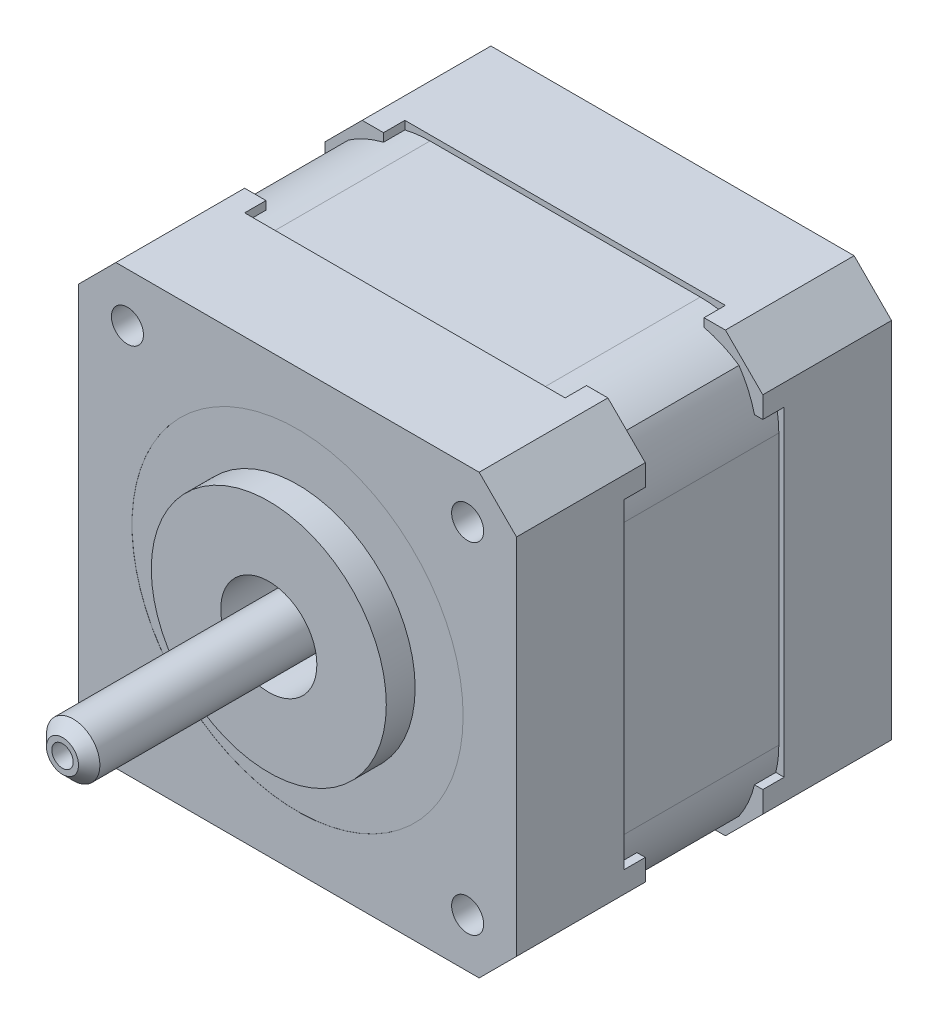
SolidWorks part; units mm, degrees
ref_plane "Ön Düzlem" through (0, 0, 0) normal (0, 0, 1) x (1, 0, 0)
ref_plane "Üst Düzlem" through (0, 0, 0) normal (0, 1, 0) x (1, 0, 0)
ref_plane "Sağ Düzlem" through (0, 0, 0) normal (1, 0, 0) x (0, 0, -1)
sketch "Çizim1" plane through (0, 0, 0) normal (0, 0, 1) x (1, 0, 0)
  line L3 (-17, 41) -> (17, 41)
  line L4 (20.5, 3.5) -> (20.5, 37.5)
  line L5 (-20.5, 3.5) -> (-20.5, 37.5)
  line L6 (17, 41) -> (20.5, 37.5)
  line L7 (-17, 41) -> (-20.5, 37.5)
  line L8 (17, 0) -> (20.5, 3.5)
  line L9 (-17, 0) -> (-20.5, 3.5)
  line L10 (-17, 0) -> (17, 0)
extrude "Yükseklik-Ekstrüzyon2" add sketch "Çizim1" along normal blind 10.05
sketch "Çizim5" plane through (0, 0, 0) normal (0, 0, -1) x (-1, 0, 0)
  line L0 (-20.5, 3.5) -> (-20.5, 5.5)
  line L1 (-20.5, 3.5) -> (-20.5, 37.5) construction
  line L2 (-20.5, 5.5) -> (-20, 5.5)
  line L3 (-17, 0) -> (-15, 0)
  line L4 (17, 0) -> (-17, 0) construction
  line L5 (-15, 0) -> (-15, 0.5)
  line L6 (20.5, 20.5) -> (10.3627, 20.5)
  line L7 (15, 0) -> (15, 0.5)
  line L8 (-20, 3.7071) -> (-20, 37.2929)
  line L9 (-20, 37.2929) -> (-16.7929, 40.5)
  line L10 (-16.7929, 40.5) -> (16.7929, 40.5)
  line L11 (16.7929, 40.5) -> (20, 37.2929)
  line L12 (20, 37.2929) -> (20, 3.7071)
  line L13 (20, 3.7071) -> (16.7929, 0.5)
  line L14 (16.7929, 0.5) -> (-16.7929, 0.5)
  line L15 (-16.7929, 0.5) -> (-20, 3.7071)
  line L16 (17, 0) -> (15, 0)
  line L17 (20.5, 5.5) -> (20, 5.5)
  line L18 (20.5, 3.5) -> (20.5, 5.5)
  line L19 (20.5, 37.5) -> (20.5, 3.5) construction
  line L20 (-20.5, 35.5) -> (-20, 35.5)
  line L21 (-15, 41) -> (-15, 40.5)
  line L22 (15, 41) -> (15, 40.5)
  line L23 (20.5, 37.5) -> (20.5, 35.5)
  line L24 (20.5, 35.5) -> (20, 35.5)
extrude "Yükseklik-Ekstrüzyon10" add sketch "Çizim5" along normal blind 2 contours L21 L20 L8 L9 L10 M5 M6 M7 | L24 L22 L10 L11 L12 M11 M4 M5 | L17 L12 L13 L14 L7 M11 M9 M10 | L14 L15 L8 L2 L5 M7 M8 M9
sketch "Çizim12" plane through (0, 0, 0) normal (0, 0, -1) x (-1, 0, 0)
  line L1 (-20.5, 5.5) -> (-20.5, 3.5)
  line L2 (-20.5, 3.5) -> (-17, 0)
  line L3 (-17, 0) -> (17, 0)
  line L4 (17, 0) -> (20.5, 3.5)
  line L5 (20.5, 3.5) -> (20.5, 37.5)
  line L6 (20.5, 37.5) -> (17, 41)
  line L7 (17, 41) -> (-17, 41)
  line L8 (-17, 41) -> (-20.5, 37.5)
  line L9 (-20.5, 37.5) -> (-20.5, 35.5)
  line L10 (-20.5, 35.5) -> (-20.4853, 35.5072)
  line L11 (-20, 35.5) -> (-20, 5.5)
  line L12 (-20, 5.5) -> (-20, 3.7071)
  line L13 (-20, 3.7071) -> (-16.7929, 0.5)
  line L14 (-16.7929, 0.5) -> (16.7929, 0.5)
  line L15 (16.7929, 0.5) -> (20, 3.7071)
  line L16 (20, 3.7071) -> (20, 37.2929)
  line L17 (20, 37.2929) -> (16.7929, 40.5)
  line L18 (16.7929, 40.5) -> (-16.7929, 40.5)
  line L19 (-16.7929, 40.5) -> (-20, 37.2929)
  line L20 (-20, 37.2929) -> (-20, 35.5)
  line L21 (-20.5, 35.5) -> (-20.5, 5.5) construction
  dimension "D1" = 0.5
extrude "Yükseklik-Ekstrüzyon11" add sketch "Çizim12" along normal blind 15 contours L18 L11 L14 L16 M17 M21 M22 M23 M3 M4 M5 M9 M10 M11 M15 M16
sketch "Çizim13" plane through (0, 0, -15) normal (0, 0, -1) x (-1, 0, 0)
  line L0 (-17, 41) -> (-20.5, 37.5)
  line L1 (-20.5, 37.5) -> (-20.5, 3.5)
  line L2 (-20.5, 3.5) -> (-17, 0)
  line L3 (-17, 0) -> (17, 0)
  line L4 (17, 0) -> (20.5, 3.5)
  line L5 (20.5, 3.5) -> (20.5, 37.5)
  line L6 (20.5, 37.5) -> (17, 41)
  line L7 (17, 41) -> (-17, 41)
extrude "Yükseklik-Ekstrüzyon12" add sketch "Çizim13" along normal blind 10.05
sketch "Çizim14" plane through (0, 0, -15) normal (0, 0, 1) x (1, 0, 0)
  line L0 (17, 41) -> (15, 41)
  line L1 (-17, 41) -> (17, 41) construction
  line L2 (15, 41) -> (15, 40.5)
  line L3 (-16.7929, 40.5) -> (16.7929, 40.5) construction
  line L4 (15, 40.5) -> (16.7929, 40.5)
  line L5 (16.7929, 40.5) -> (20, 37.2929)
  line L6 (20.5, 37.5) -> (20.5, 35.5)
  line L7 (20.5, 37.5) -> (20.5, 3.5) construction
  line L8 (20.5, 35.5) -> (20, 35.5)
  line L9 (20, 37.2929) -> (20, 3.7071) construction
  line L10 (20, 35.5) -> (20, 37.2929)
  line L11 (20.5, 37.5) -> (17, 41)
  line L12 (0, 0) -> (0, 15.5815)
  line L13 (17, 0) -> (15, 0)
  line L14 (15, 0) -> (15, 0.5)
  line L15 (15, 0.5) -> (16.7929, 0.5)
  line L16 (20.5, 3.5) -> (17, 0)
  line L17 (16.7929, 0.5) -> (20, 3.7071)
  line L18 (20, 5.5) -> (20, 3.7071)
  line L19 (20.5, 3.5) -> (20.5, 5.5)
  line L20 (20.5, 5.5) -> (20, 5.5)
  line L21 (-20.5, 5.5) -> (-20, 5.5)
  line L22 (-20.5, 3.5) -> (-20.5, 5.5)
  line L23 (-20, 5.5) -> (-20, 3.7071)
  line L24 (-20.5, 3.5) -> (-17, 0)
  line L25 (-16.7929, 0.5) -> (-20, 3.7071)
  line L26 (-15, 0.5) -> (-16.7929, 0.5)
  line L27 (-15, 0) -> (-15, 0.5)
  line L28 (-17, 0) -> (-15, 0)
  line L29 (-20.5, 35.5) -> (-20, 35.5)
  line L30 (-20, 35.5) -> (-20, 37.2929)
  line L31 (-20.5, 37.5) -> (-20.5, 35.5)
  line L32 (-20.5, 37.5) -> (-17, 41)
  line L33 (-16.7929, 40.5) -> (-20, 37.2929)
  line L34 (-15, 40.5) -> (-16.7929, 40.5)
  line L35 (-17, 41) -> (-15, 41)
  line L36 (-15, 41) -> (-15, 40.5)
extrude "Yükseklik-Ekstrüzyon14" add sketch "Çizim14" along normal blind 2 contours L36 L29 M19 M20 M21 M31 M32 M33 | L27 L21 M23 M29 M30 M31 M21 M22 | L20 L14 M25 M27 M28 M29 M23 M24 | L8 L2 M25 M26 M19 M33 M34 M27
fillet "Radyus5" radius 10 8 edges at (-20, 3.7071, -7.5) (-16.7929, 0.5, -7.5) (-16.7929, 40.5, -7.5) (-20, 37.2929, -7.5) (20, 37.2929, -7.5) (16.7929, 40.5, -7.5) (20, 3.7071, -7.5) (16.7929, 0.5, -7.5)
sketch "Çizim15" plane through (0, 0, -25.05) normal (0, 0, -1) x (-1, 0, 0)
  circle A0 centre (0, 20.5) radius 4.5
extrude "Kes-Ekstrüzyon3" cut sketch "Çizim15" against normal blind 3
fillet "Radyus6" radius 0.5 1 edges at (-4.5, 20.5, -25.05)
sketch "Çizim16" plane through (0, 0, -22.05) normal (0, 0, -1) x (-1, 0, 0)
  circle A0 centre (0, 20.5) radius 3
extrude "Yükseklik-Ekstrüzyon15" add sketch "Çizim16" along normal blind 1
fillet "Radyus7" radius 0.5 1 edges at (-3, 20.5, -23.05)
sketch "Çizim17" plane through (0, 0, -23.05) normal (0, 0, -1) x (-1, 0, 0)
  line L1 (1.2603, 19.7965) -> (1.2394, 21.2397)
  line L2 (1.2394, 21.2397) -> (-0.0209, 21.9432)
  line L3 (-0.0209, 21.9432) -> (-1.2603, 21.2035)
  line L4 (-1.2603, 21.2035) -> (-1.2394, 19.7603)
  line L5 (-1.2394, 19.7603) -> (0.0209, 19.0568)
  line L6 (0.0209, 19.0568) -> (1.2603, 19.7965)
  circle A0 centre (0, 20.5) radius 1.25 construction
extrude "Kes-Ekstrüzyon4" cut sketch "Çizim17" against normal blind 0.5
sketch "Çizim18" plane through (0, 0, -25.05) normal (0, 0, -1) x (-1, 0, 0)
  line L0 (0, 20.5) -> (0, 35.5)
  line L1 (0, 20.5) -> (15, 20.5)
  line L2 (0, 35.5) -> (15, 35.5)
  line L3 (15, 35.5) -> (15, 20.5)
  circle A0 centre (15, 35.5) radius 3
  circle A1 centre (15, 5.5) radius 3
  circle A2 centre (-15, 5.5) radius 3
  circle A3 centre (-15, 35.5) radius 3
extrude "Kes-Ekstrüzyon5" cut sketch "Çizim18" against normal blind 1 contours A2 | A0 | A1 | A3
sketch "Çizim19" plane through (0, 0, -24.05) normal (0, 0, -1) x (-1, 0, 0)
  circle A0 centre (15, 35.5) radius 2
  circle A1 centre (15, 5.5) radius 2
  circle A2 centre (-15, 5.5) radius 2
  circle A3 centre (-15, 35.5) radius 2
extrude "Yükseklik-Ekstrüzyon17" add sketch "Çizim19" along normal blind 0.5
fillet "Radyus8" radius 0.5 4 edges at (13, 5.5, -24.55) (-13, 5.5, -24.55) (-17, 35.5, -24.55) (17, 35.5, -24.55)
sketch "Çizim21" plane through (0, 0, -24.55) normal (0, 0, -1) x (-1, 0, 0)
  line L0 (0, 20.5) -> (9.2525, 20.5)
  line L1 (9.2525, 20.5) -> (0, 20.5)
  line L2 (0, 20.5) -> (0, 30.2455)
  line L3 (15.15, 6.5) -> (14.85, 6.5)
  line L4 (15.15, 35.65) -> (15.15, 36.5)
  line L5 (15.15, 35.35) -> (16, 35.35)
  line L6 (14.85, 35.35) -> (14.85, 34.5)
  line L7 (14.85, 35.65) -> (14, 35.65)
  line L8 (14.85, 35.65) -> (14.85, 36.5)
  line L9 (15.15, 35.65) -> (16, 35.65)
  line L10 (15.15, 35.35) -> (15.15, 34.5)
  line L11 (14.85, 35.35) -> (14, 35.35)
  line L12 (14.85, 36.5) -> (15.15, 36.5)
  line L13 (16, 35.65) -> (16, 35.35)
  line L14 (15.15, 34.5) -> (14.85, 34.5)
  line L15 (14, 35.35) -> (14, 35.65)
  line L16 (14, 35.65) -> (14.0342, 35.6422)
  line L17 (14, 5.35) -> (14.0342, 5.3578)
  line L18 (14, 5.65) -> (14, 5.35)
  line L19 (16, 5.35) -> (16, 5.65)
  line L20 (14.85, 5.65) -> (14, 5.65)
  line L21 (15.15, 5.65) -> (15.15, 6.5)
  line L22 (15.15, 5.35) -> (16, 5.35)
  line L23 (14.85, 5.35) -> (14, 5.35)
  line L24 (14.85, 5.65) -> (14.85, 6.5)
  line L25 (15.15, 5.65) -> (16, 5.65)
  line L26 (14.85, 4.5) -> (15.15, 4.5)
  line L27 (14.85, 5.35) -> (14.85, 4.5)
  line L28 (15.15, 5.35) -> (15.15, 4.5)
  line L29 (-14, 35.65) -> (-14.0342, 35.6422)
  line L30 (-14, 35.35) -> (-14, 35.65)
  line L31 (-14.85, 36.5) -> (-15.15, 36.5)
  line L32 (-15.15, 34.5) -> (-14.85, 34.5)
  line L33 (-16, 35.65) -> (-16, 35.35)
  line L34 (-14.85, 35.35) -> (-14, 35.35)
  line L35 (-15.15, 35.35) -> (-15.15, 34.5)
  line L36 (-15.15, 35.65) -> (-16, 35.65)
  line L37 (-14.85, 35.65) -> (-14.85, 36.5)
  line L38 (-14.85, 35.65) -> (-14, 35.65)
  line L39 (-14.85, 35.35) -> (-14.85, 34.5)
  line L40 (-15.15, 35.35) -> (-16, 35.35)
  line L41 (-15.15, 35.65) -> (-15.15, 36.5)
  line L42 (-16, 5.35) -> (-16, 5.65)
  line L43 (-15.15, 5.35) -> (-15.15, 4.5)
  line L44 (-14.85, 5.35) -> (-14.85, 4.5)
  line L45 (-14.85, 4.5) -> (-15.15, 4.5)
  line L46 (-15.15, 5.65) -> (-16, 5.65)
  line L47 (-14.85, 5.65) -> (-14.85, 6.5)
  line L48 (-14.85, 5.35) -> (-14, 5.35)
  line L49 (-15.15, 5.35) -> (-16, 5.35)
  line L50 (-15.15, 5.65) -> (-15.15, 6.5)
  line L51 (-14.85, 5.65) -> (-14, 5.65)
  line L52 (-14, 5.65) -> (-14, 5.35)
  line L53 (-14, 5.35) -> (-14.0342, 5.3578)
  line L54 (-15.15, 6.5) -> (-14.85, 6.5)
  point P0 (15, 35.5)
  point P1 (15, 36.5)
  point P3 (15.15, 35.5)
  point P4 (16, 35.5)
  point P5 (15, 34.5)
  point P10 (14.85, 35.5)
  point P14 (14.85, 35.5)
extrude "Kes-Ekstrüzyon6" cut sketch "Çizim21" against normal blind 0.1
sketch "Çizim22" plane through (0, 0, 10.05) normal (0, 0, 1) x (1, 0, 0)
  circle A0 centre (0, 20.5) radius 4.5
extrude "Kes-Ekstrüzyon7" cut sketch "Çizim22" against normal blind 3
sketch "Çizim23" plane through (0, 0, 7.05) normal (0, 0, 1) x (1, 0, 0)
  circle A0 centre (0, 20.5) radius 2.5
extrude "Yükseklik-Ekstrüzyon18" add sketch "Çizim23" along normal blind 25
sketch "Çizim24" plane through (0, 0, 32.05) normal (0, 0, 1) x (1, 0, 0)
  circle A0 centre (0, 20.5) radius 1
extrude "Kes-Ekstrüzyon8" cut sketch "Çizim24" against normal blind 2
chamfer "Pah1" distance 1 angle 45 1 edges at (2.5, 20.5, 32.05)
sketch "Çizim25" plane through (0, 0, 10.05) normal (0, 0, 1) x (1, 0, 0)
  line L0 (20.5, 20.5) -> (15.5, 20.5)
  line L1 (20.5, 3.5) -> (20.5, 37.5) construction
  circle A0 centre (0, 20.5) radius 4.5
  circle A1 centre (0, 20.5) radius 15.5
extrude "Kes-Ekstrüzyon9" cut sketch "Çizim25" against normal blind 0.01 contours A1 M2
sketch "Çizim26" plane through (0, 0, 10.04) normal (0, 0, 1) x (1, 0, 0)
  line L0 (15.5, 20.5) -> (11, 20.5)
  circle A0 centre (0, 20.5) radius 4.5
  circle A1 centre (0, 20.5) radius 15.5 construction
  circle A2 centre (0, 20.5) radius 11
  dimension "D1" = 22
extrude "Yükseklik-Ekstrüzyon19" add sketch "Çizim26" along normal blind 2.7 contours A2 M2
sketch "Çizim28" plane through (0, 0, 10.05) normal (0, 0, 1) x (1, 0, 0)
  line L2 (0, 20.5) -> (0, 27.7903)
  line L3 (0, 27.7903) -> (0, 20.5)
  line L4 (0, 20.5) -> (6.5303, 20.5)
  circle A0 centre (-15.9216, 36.4216) radius 1.5
  circle A1 centre (15.9216, 36.4216) radius 1.5
  circle A2 centre (-15.9216, 4.5784) radius 1.5
  circle A3 centre (15.9216, 4.5784) radius 1.5
extrude "Kes-Ekstrüzyon10" cut sketch "Çizim28" against normal blind 6 contours A1 | A0 | A3 | A2
